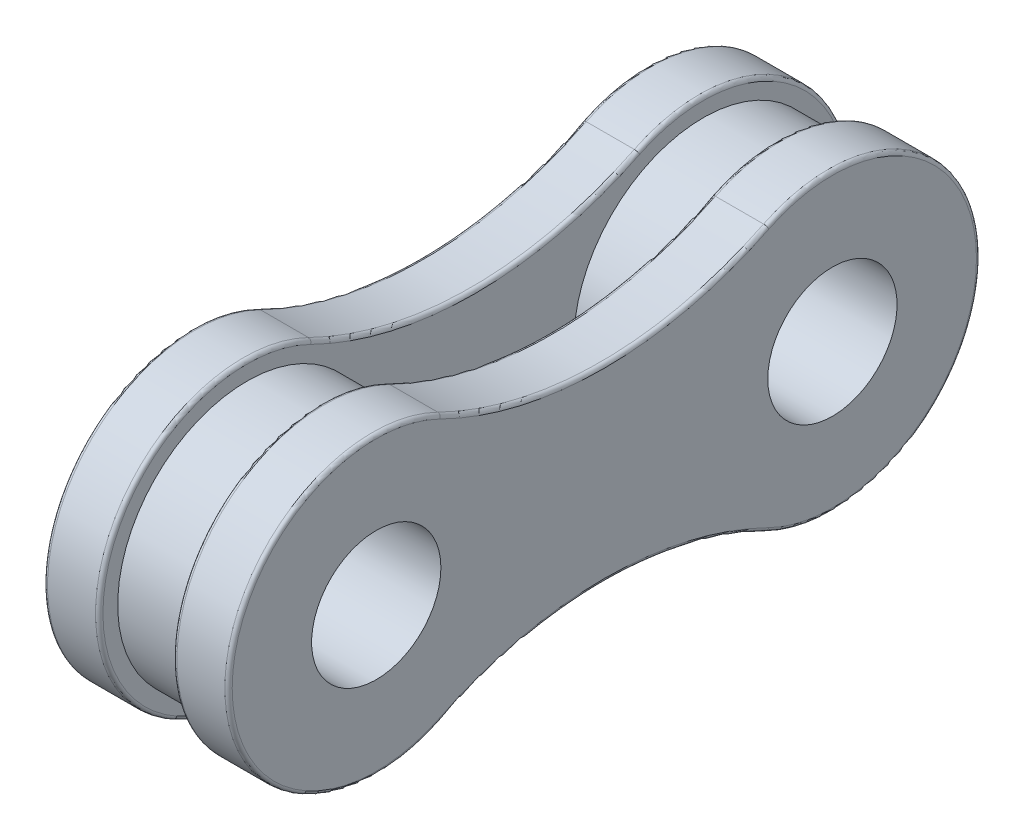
SolidWorks part; units mm, degrees
ref_plane "Front Plane" through (0, 0, 0) normal (0, 0, 1) x (1, 0, 0)
ref_plane "Top Plane" through (0, 0, 0) normal (0, 1, 0) x (1, 0, 0)
ref_plane "Right Plane" through (0, 0, 0) normal (1, 0, 0) x (0, 0, -1)
sketch "Sketch1" plane through (0, 0, 0) normal (1, 0, 0) x (0, 0, -1)
  line L0 (-6.175, 0) -> (6.175, 0) construction
  line L1 (0, 0) -> (0, 8.3897) construction
  circle A0 centre (-6.175, 0) radius 1.75
  arc A1 (-4.4107, 3.5899) -> (-4.4107, -3.5899) centre (-6.175, 0) ccw
  circle A2 centre (6.175, 0) radius 1.75
  arc A3 (4.4107, 3.5899) -> (4.4107, -3.5899) centre (6.175, 0) cw
  arc A4 (-4.4107, 3.5899) -> (4.4107, 3.5899) centre (0, 12.5646) ccw
  arc A5 (-4.4107, -3.5899) -> (4.4107, -3.5899) centre (0, -12.5646) cw
  point P12 (0, 0)
  dimension "D2" = 8
  dimension "D3" = 3.5
  dimension "D4" = 10
  dimension "D1" = 12.35
extrude "Boss-Extrude1" add sketch "Sketch1" along normal blind 1.5 from offset 1
sketch "Sketch2" plane through (0, 0, 0) normal (1, 0, 0) x (0, 0, -1)
  circle A0 centre (6.175, 0) radius 1.75 construction
  circle A1 centre (-6.175, 0) radius 1.75 construction
  circle A2 centre (6.175, 0) radius 1.75
  circle A3 centre (-6.175, 0) radius 1.75
  arc A4 (4.4107, -3.5899) -> (-4.4107, -3.5899) centre (0, -12.5646) ccw construction
  arc A5 (4.4107, -3.5899) -> (4.4107, 3.5899) centre (6.175, 0) ccw construction
  arc A6 (-4.4107, 3.5899) -> (4.4107, 3.5899) centre (0, 12.5646) ccw construction
  arc A7 (-4.4107, 3.5899) -> (-4.4107, -3.5899) centre (-6.175, 0) ccw construction
  arc A8 (4.4107, -3.5899) -> (-4.4107, -3.5899) centre (0, -12.5646) ccw
  arc A9 (4.4107, -3.5899) -> (4.4107, 3.5899) centre (6.175, 0) ccw
  arc A10 (-4.4107, 3.5899) -> (4.4107, 3.5899) centre (0, 12.5646) ccw
  arc A11 (-4.4107, 3.5899) -> (-4.4107, -3.5899) centre (-6.175, 0) ccw
extrude "Boss-Extrude2" add sketch "Sketch2" against normal blind 1.5 from offset 1 separate body
sketch "Sketch3" plane through (0, 0, 0) normal (1, 0, 0) x (0, 0, -1)
  circle A0 centre (6.175, 0) radius 1.75 construction
  circle A1 centre (-6.175, 0) radius 1.75 construction
  circle A2 centre (6.175, 0) radius 1.75
  circle A3 centre (-6.175, 0) radius 1.75
  circle A4 centre (-6.175, 0) radius 3.5
  circle A5 centre (6.175, 0) radius 3.5
  dimension "D1" = 7
extrude "Boss-Extrude3" add sketch "Sketch3" along normal mid plane 2
fillet "Fillet1" radius 0.1 16 edges at (2.5, 0, -10.175) (2.5, -2.5646, 0) (2.5, 0, 10.175) (1, 0, -10.175) (1, -2.5646, 0) (1, 0, 10.175) (-1, 0, -10.175) (-1, -2.5646, 0) (-1, 0, 10.175) (-2.5, 0, -10.175) (-2.5, -2.5646, 0) (-2.5, 0, 10.175) (2.5, 2.5646, 0) (1, 2.5646, 0) (-1, 2.5646, 0) (-2.5, 2.5646, 0)
